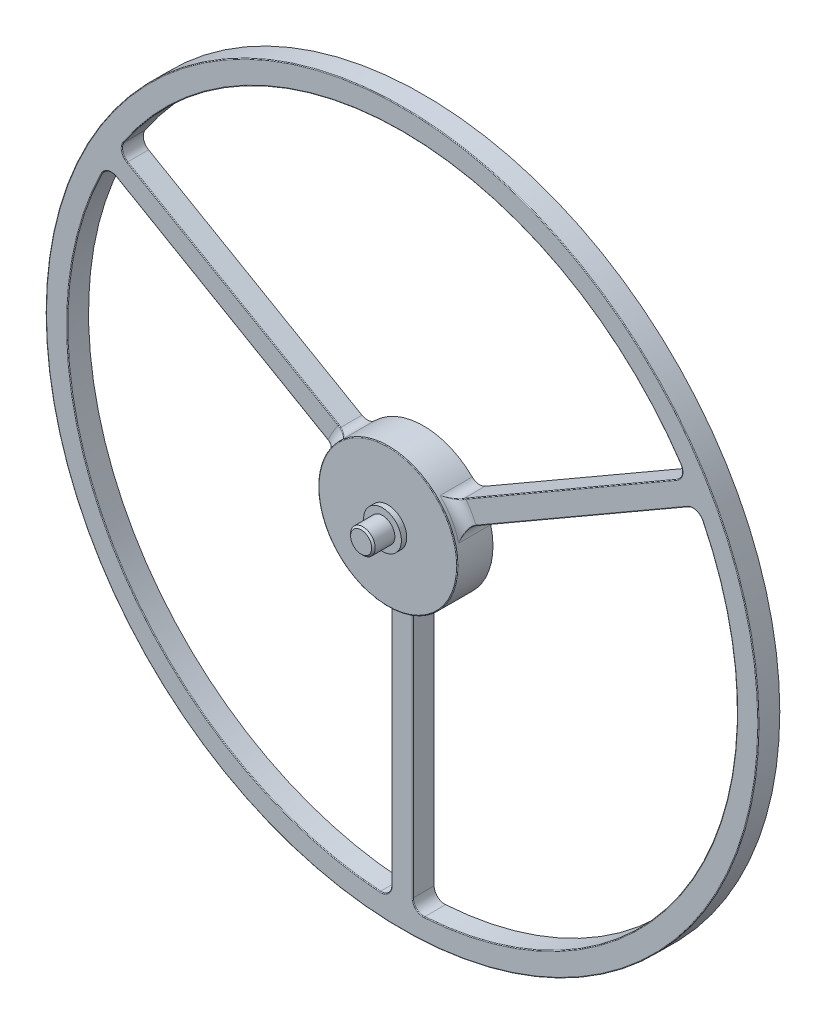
SolidWorks part; units mm, degrees
ref_plane "Alzado" through (0, 0, 0) normal (0, 0, 1) x (1, 0, 0)
ref_plane "Planta" through (0, 0, 0) normal (0, 1, 0) x (1, 0, 0)
ref_plane "Vista lateral" through (0, 0, 0) normal (1, 0, 0) x (0, 0, -1)
sketch "Croquis1" plane through (0, 0, 0) normal (0, 0, 1) x (1, 0, 0)
  line L0 (0, 0) -> (86.6025, 50) construction
  line L1 (0, 0) -> (-86.6025, 50) construction
  line L2 (0, 0) -> (0, -100) construction
  line L3 (1.5, 2.5981) -> (-85.1025, 52.5981)
  line L4 (1.5, -2.5981) -> (88.1025, 47.4019)
  line L5 (-3, 0) -> (-3, -100)
  line L6 (-1.5, -2.5981) -> (-88.1025, 47.4019)
  line L7 (-1.5, 2.5981) -> (85.1025, 52.5981)
  line L8 (3, 0) -> (3, -100)
  circle A0 centre (0, 0) radius 9.5
  circle A1 centre (0, 0) radius 3.5
  circle A2 centre (0, 0) radius 100
  circle A3 centre (0, 0) radius 19.5
  dimension "D1" = 19
  dimension "D2" = 7
  dimension "D3" = 200
  dimension "D6" = 10
  dimension "D4" = 120
  dimension "D5" = 120
  dimension "D7" = 3
  dimension "D8" = 3
sketch "Croquis2" plane through (0, 0, 0) normal (0, 0, 1) x (1, 0, 0)
  circle A0 centre (0, 0) radius 19.5 construction
  circle A1 centre (0, 0) radius 19.5
extrude "Saliente-Extruir1" add sketch "Croquis2" along normal blind 10
sketch "Croquis3" plane through (0, 0, 0) normal (0, 0, 1) x (1, 0, 0)
  line L0 (-3, 0) -> (-3, -100) construction
  line L1 (3, 0) -> (3, -100) construction
  line L2 (1.5, -2.5981) -> (88.1025, 47.4019) construction
  line L3 (-1.5, 2.5981) -> (85.1025, 52.5981) construction
  line L4 (1.5, 2.5981) -> (-85.1025, 52.5981) construction
  line L5 (-1.5, -2.5981) -> (-88.1025, 47.4019) construction
  line L6 (-3, -19.2678) -> (-3, -93.9521)
  line L7 (3, -19.2678) -> (3, -93.9521)
  line L8 (18.1864, 7.0358) -> (82.8649, 44.378)
  line L9 (15.1864, 12.232) -> (79.8649, 49.5741)
  line L10 (-15.1864, 12.232) -> (-79.8649, 49.5741)
  line L11 (-18.1864, 7.0358) -> (-82.8649, 44.378)
  circle A0 centre (0, 0) radius 19.5 construction
  arc A1 (-15.1864, 12.232) -> (-18.1864, 7.0358) centre (0, 0) ccw
  circle A2 centre (0, 0) radius 100 construction
  circle A3 centre (0, 0) radius 100
  arc A4 (18.1864, 7.0358) -> (15.1864, 12.232) centre (0, 0) ccw
  arc A5 (-3, -19.2678) -> (3, -19.2678) centre (0, 0) ccw
  arc A6 (-82.8649, 44.378) -> (-3, -93.9521) centre (0, 0) ccw
  arc A7 (79.8649, 49.5741) -> (-79.8649, 49.5741) centre (0, 0) ccw
  circle A8 centre (0, 0) radius 94 construction
  arc A9 (3, -93.9521) -> (82.8649, 44.378) centre (0, 0) ccw
  point P24 (94, 0)
  dimension "D1" = 6
extrude "Saliente-Extruir2" add sketch "Croquis3" along normal blind 6
fillet "Redondeo1" radius 3 15 edges at (-3, -93.9521, 3) (3, -93.9521, 3) (79.8649, 49.5741, 3) (82.8649, 44.378, 3) (-82.8649, 44.378, 3) (-79.8649, 49.5741, 3) (-18.1864, 7.0358, 3) (-16.8875, 9.75, 6) (-15.1864, 12.232, 3) (15.1864, 12.232, 3) (16.8875, 9.75, 6) (18.1864, 7.0358, 3) (-3, -19.2678, 3) (3, -19.2678, 3) (0, -19.5, 6)
sketch "Croquis4" plane through (0, 0, 10) normal (0, 0, 1) x (1, 0, 0)
  circle A0 centre (0, 0) radius 5.3
  dimension "D1" = 10.6
extrude "Saliente-Extruir3" add sketch "Croquis4" along normal blind 1.5
sketch "Croquis5" plane through (0, 0, 11.5) normal (0, 0, 1) x (1, 0, 0)
  circle A3 centre (0, 0) radius 3.46
  circle A4 centre (0, 0) radius 3.46
  dimension "D1" = 0.04
extrude "Saliente-Extruir4" add sketch "Croquis5" along normal blind 6
chamfer "Chaflán1" distance 0.5 angle 45 1 edges at (3.46, 0, 17.5)
fillet "Redondeo2" radius 0.2 29 edges at (15.7196, 13.0394, 6.8345) (47.4742, 30.8733, 6) (78.5586, 49.9167, 6) (-15.7196, 13.0394, 6.8345) (-47.4742, 30.8733, 6) (-78.5586, 49.9167, 6) (3.4326, -20.1333, 6.8345) (3, -56.5505, 6) (3.9498, -92.9921, 6) (19.1523, 7.0939, 6.8345) (50.4742, 25.6772, 6) (82.5084, 43.0754, 6) (-19.1523, 7.0939, 6.8345) (-50.4742, 25.6772, 6) (-82.5084, 43.0754, 6) (-3.4326, -20.1333, 6.8345) (-3, -56.5505, 6) (-3.9498, -92.9921, 6) (0, 94, 6) (81.4064, -47, 6) (100, 0, 6) (-81.4064, -47, 6) (19.5, 0, 10)
